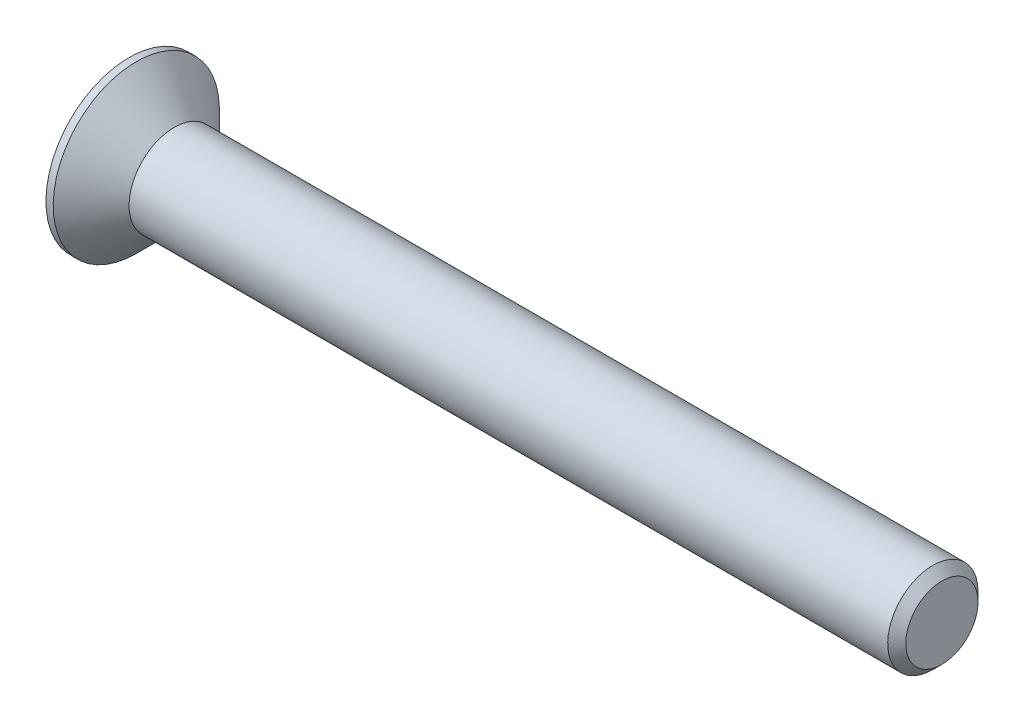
SolidWorks part; units mm, degrees
ref_plane "Front Plane" through (0, 0, 0) normal (0, 0, 1) x (1, 0, 0)
ref_plane "Top Plane" through (0, 0, 0) normal (0, 1, 0) x (1, 0, 0)
ref_plane "Right Plane" through (0, 0, 0) normal (1, 0, 0) x (0, 0, -1)
sketch "Sketch1" plane through (0, 0, 0) normal (0, 0, 1) x (1, 0, 0)
  line L1 (-2.5, 4.6) -> (-2.5, 0)
  line L2 (-2.5, 0) -> (42.5, 0)
  line L3 (42.5, 0) -> (42.5, 2.5)
  line L4 (42.5, 2.5) -> (0, 2.5)
  line L5 (-2.5, 4.6) -> (-2.1, 4.6)
  line L6 (-2.1, 4.6) -> (0, 2.5)
  dimension "D1" = 2.5
  dimension "D2" = 45
  dimension "D3" = 2.5
  dimension "D4" = 45
  dimension "D5" = 4.6
revolve "Revolve1" add sketch "Sketch1" angle 360 about L2
chamfer "Chamfer1" distance 0.5 angle 45 1 edges at (42.5, -2.5, 0)
sketch "Sketch2" plane through (-2.5, 0, 0) normal (-1, 0, 0) x (0, 0, 1)
  line L0 (-0.575, 2.3) -> (0.575, 2.3)
  line L1 (0.575, 2.3) -> (0.575, 0.575)
  line L2 (0.575, 0.575) -> (2.3, 0.575)
  line L3 (2.3, 0.575) -> (2.3, -0.575)
  line L4 (2.3, -0.575) -> (0.575, -0.575)
  line L5 (0.575, -0.575) -> (0.575, -2.3)
  line L6 (0.575, -2.3) -> (-0.575, -2.3)
  line L7 (-0.575, -2.3) -> (-0.575, -0.575)
  line L8 (-0.575, -0.575) -> (-2.3, -0.575)
  line L9 (-2.3, -0.575) -> (-2.3, 0.575)
  line L10 (-2.3, 0.575) -> (-0.575, 0.575)
  line L11 (-0.575, 0.575) -> (-0.575, 2.3)
  point P2 (0, 2.3)
  point P14 (0, -2.3)
  point P15 (2.3, 0)
  point P16 (-2.3, 0)
  dimension "D1" = 4.6
  dimension "D2" = 1.15
extrude "Cut-Extrude1" cut sketch "Sketch2" against normal blind 2.1
